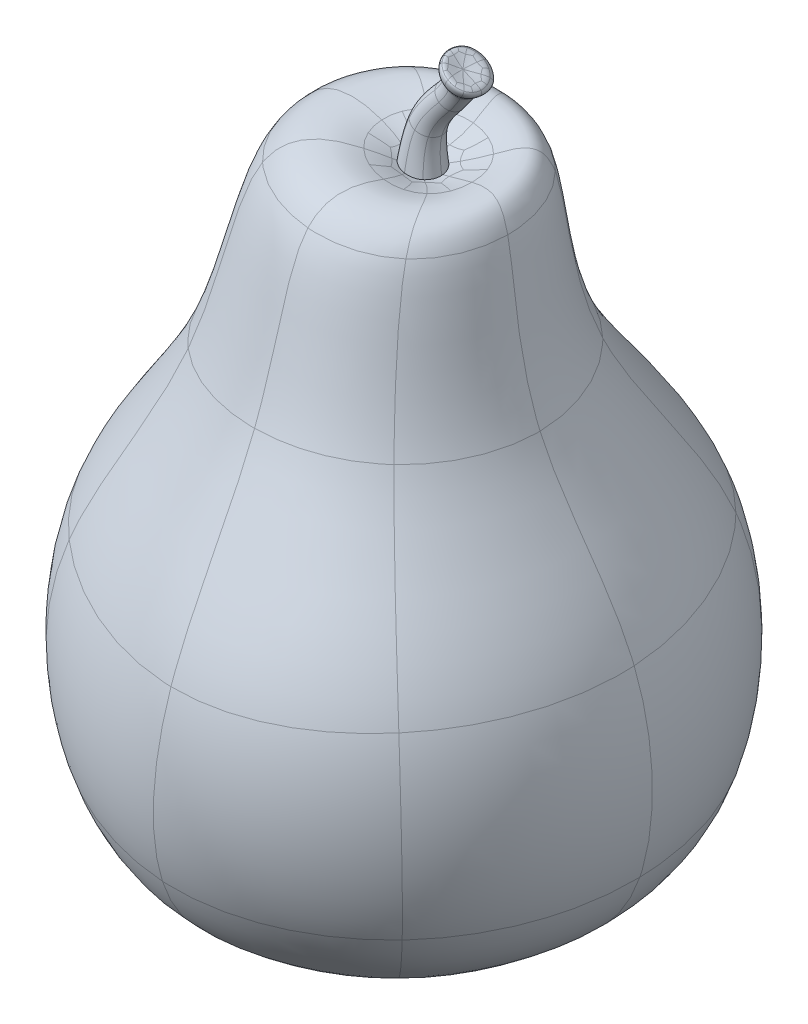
SolidWorks part; units mm, degrees
ref_plane "Front Plane" through (0, 0, 0) normal (0, 0, 1) x (1, 0, 0)
ref_plane "Top Plane" through (0, 0, 0) normal (0, 1, 0) x (1, 0, 0)
ref_plane "Right Plane" through (0, 0, 0) normal (1, 0, 0) x (0, 0, -1)
imported_body "Irregular Pear Test (1).step<1>"
move or copy body "Body-Move/Copy1" bodies to move or copy 102 101 copy no rotation origin (0, 0.9924, 73.9135) rotation axis (-1, 0, 0) rotation angle 90
scale "Scale1" bodies to scale 104 103 scale about origin uniform scaling yes scale factor 0.6
